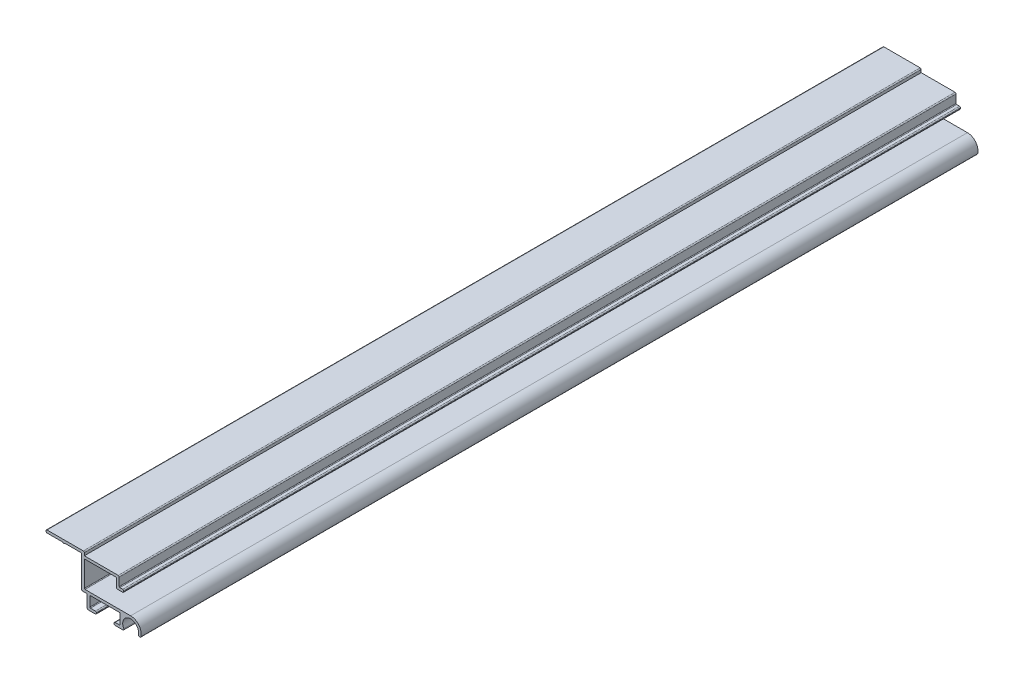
SolidWorks part; units mm, degrees
ref_plane "Plan de face" through (0, 0, 0) normal (0, 0, 1) x (1, 0, 0)
ref_plane "Plan de dessus" through (0, 0, 0) normal (0, 1, 0) x (1, 0, 0)
ref_plane "Plan de droite" through (0, 0, 0) normal (1, 0, 0) x (0, 0, -1)
sketch "Esquisse1" plane through (0, 0, 0) normal (0, 0, 1) x (1, 0, 0)
  line L0 (-7.19, 0) -> (-13.1, 0)
  line L1 (-0.25, 0) -> (-6.31, 0)
  line L2 (0, -8.04) -> (0, -11.9)
  line L3 (0.6, 1) -> (-13.1, 1)
  line L4 (-13.5, 0.4) -> (-13.5, 0.6)
  line L5 (1, -1.65) -> (1, -11.05)
  line L6 (1.25, -11.3) -> (18.5, -11.3)
  line L7 (0, -0.25) -> (0, -7.0921)
  line L8 (1, -12.3) -> (0.4, -12.3)
  line L9 (1, 0.6) -> (1, -0.4)
  line L10 (1, -0.4) -> (13.8, -0.4)
  line L11 (0, -7.0921) -> (0, -8.04)
  line L12 (1.25, -1.4) -> (12.95, -1.4)
  line L13 (1, -12.3) -> (1.8073, -12.3)
  line L14 (2.0573, -12.55) -> (2.0573, -17)
  line L15 (14.2, -0.8) -> (14.2, -3.85)
  line L16 (2.4573, -17.4) -> (5.1573, -17.4)
  line L17 (13.2, -1.65) -> (13.2, -4.7)
  line L18 (13.6, -5.1) -> (15.5, -5.1)
  line L19 (3.0573, -12.55) -> (3.0573, -16.15)
  line L20 (14.45, -4.1) -> (15.5, -4.1)
  line L21 (15.9, -4.7) -> (15.9, -4.5)
  line L22 (15.5553, -17.4) -> (12.6573, -17.4)
  line L23 (21.6729, -16.4549) -> (21.8619, -16.5236)
  line L24 (3.3073, -16.4) -> (5.1573, -16.4)
  line L25 (5.5573, -16.8) -> (5.5573, -17)
  line L26 (3.3073, -12.3) -> (14.25, -12.3)
  line L27 (12.2573, -17) -> (12.2573, -16.8)
  line L28 (14.5, -12.55) -> (14.5, -16.15)
  line L29 (12.6573, -16.4) -> (14.25, -16.4)
  arc A0 (-7.19, 0) -> (-6.31, 0) centre (-6.75, 0.33) ccw
  arc A1 (22.3875, -16.242) -> (18.5, -11.3) centre (18.5, -15.3) ccw
  arc A2 (21.4204, -15.9873) -> (15.9017, -16.8) centre (18.5, -15.3) ccw
  arc A3 (21.8619, -16.5236) -> (22.3875, -16.242) centre (21.9988, -16.1478) ccw
  arc A4 (21.6729, -16.4549) -> (21.4204, -15.9873) centre (21.8097, -16.079) cw
  arc A5 (15.9017, -16.8) -> (15.5553, -17.4) centre (15.5553, -17) cw
  arc A6 (12.2573, -16.8) -> (12.6573, -16.4) centre (12.6573, -16.8) cw
  arc A7 (12.6573, -17.4) -> (12.2573, -17) centre (12.6573, -17) cw
  arc A8 (13.6, -5.1) -> (13.2, -4.7) centre (13.6, -4.7) cw
  arc A9 (15.5, -5.1) -> (15.9, -4.7) centre (15.5, -4.7) ccw
  arc A10 (15.5, -4.1) -> (15.9, -4.5) centre (15.5, -4.5) cw
  arc A11 (14.2, -0.8) -> (13.8, -0.4) centre (13.8, -0.8) ccw
  arc A12 (5.1573, -16.4) -> (5.5573, -16.8) centre (5.1573, -16.8) cw
  arc A13 (5.1573, -17.4) -> (5.5573, -17) centre (5.1573, -17) ccw
  arc A14 (2.0573, -17) -> (2.4573, -17.4) centre (2.4573, -17) ccw
  arc A15 (0, -11.9) -> (0.4, -12.3) centre (0.4, -11.9) ccw
  arc A16 (0.6, 1) -> (1, 0.6) centre (0.6, 0.6) cw
  arc A17 (-13.1, 0) -> (-13.5, 0.4) centre (-13.1, 0.4) cw
  arc A18 (-13.1, 1) -> (-13.5, 0.6) centre (-13.1, 0.6) ccw
  arc A19 (3.0573, -16.15) -> (3.3073, -16.4) centre (3.3073, -16.15) ccw
  arc A20 (14.5, -16.15) -> (14.25, -16.4) centre (14.25, -16.15) cw
  arc A21 (14.5, -12.55) -> (14.25, -12.3) centre (14.25, -12.55) ccw
  arc A22 (2.0573, -12.55) -> (1.8073, -12.3) centre (1.8073, -12.55) ccw
  arc A23 (3.0573, -12.55) -> (3.3073, -12.3) centre (3.3073, -12.55) cw
  arc A24 (1.25, -11.3) -> (1, -11.05) centre (1.25, -11.05) cw
  arc A25 (14.45, -4.1) -> (14.2, -3.85) centre (14.45, -3.85) cw
  arc A26 (13.2, -1.65) -> (12.95, -1.4) centre (12.95, -1.65) ccw
  arc A27 (1, -1.65) -> (1.25, -1.4) centre (1.25, -1.65) cw
  arc A28 (-0.25, 0) -> (0, -0.25) centre (-0.25, -0.25) cw
  point P31 (22.2588, -16.6681)
  point P41 (21.3192, -16.3261)
  point P44 (16.3573, -17.4)
  point P49 (12.2573, -17.4)
  point P54 (15.9, -5.1)
  point P57 (15.9, -4.1)
  point P60 (14.2, -0.4)
  point P63 (5.5573, -16.4)
  point P66 (5.5573, -17.4)
  point P69 (2.0573, -17.4)
  point P74 (1, 1)
  point P77 (-13.5, 0)
  point P80 (-13.5, 1)
  point P89 (2.0573, -12.3)
  point P92 (3.0573, -12.3)
  point P95 (1, -11.3)
  point P98 (14.2, -4.1)
  point P105 (0, 0)
  dimension "D3" = 1.1
  dimension "D15" = 6.1
  dimension "D18" = 17.5
  dimension "D16" = 8
  dimension "D30" = 0.4
  dimension "D31" = 0.25
  dimension "D1" = 13.5
  dimension "D2" = 1
  dimension "D4" = 14.3
  dimension "D5" = 0.33
  dimension "D7" = 13.2
  dimension "D6" = 4.1
  dimension "D8" = 1.4
  dimension "D9" = 1
  dimension "D10" = 3.7
  dimension "D11" = 11.9
  dimension "D12" = 1
  dimension "D13" = 2.7
  dimension "D14" = 1
  dimension "D17" = 3.5
  dimension "D19" = 18.5
  dimension "D20" = 4
  dimension "D21" = 1
  dimension "D22" = 1
  dimension "D23" = 1
  dimension "D24" = 5.1
  dimension "D25" = 2.0573
  dimension "D26" = 4.1
  dimension "D27" = 160
  dimension "D28" = 6.75
  dimension "D29" = 0.9998
extrude "Boss.-Extru.1" add sketch "Esquisse1" along normal blind 316.5
